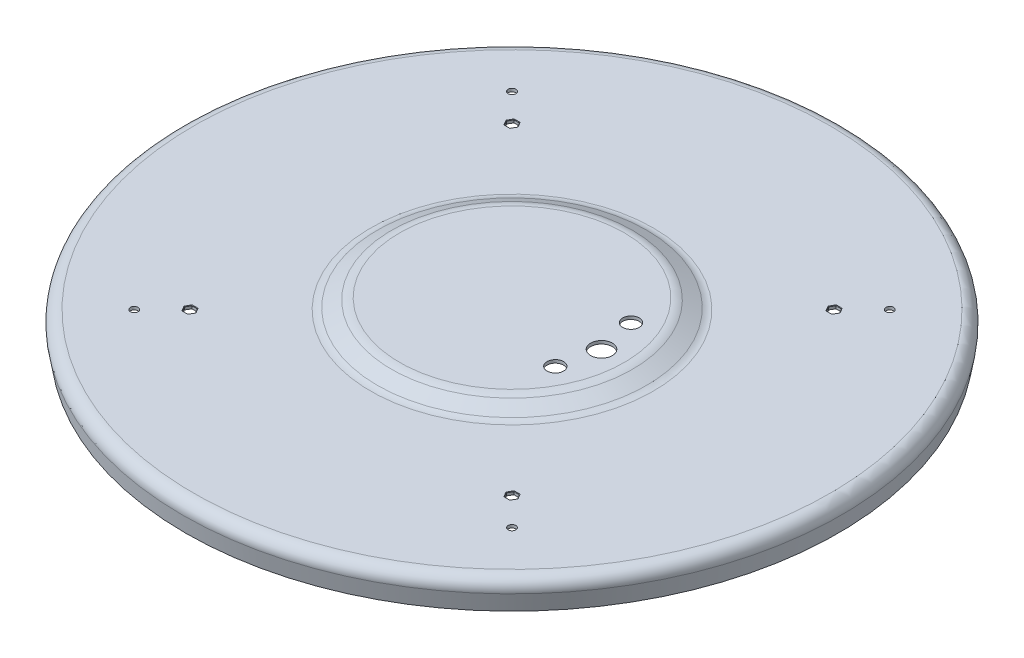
SolidWorks part; units mm, degrees
ref_plane "Plan de face" through (0, 0, 0) normal (0, 0, 1) x (1, 0, 0)
ref_plane "Plan de dessus" through (0, 0, 0) normal (0, 1, 0) x (1, 0, 0)
ref_plane "Plan de droite" through (0, 0, 0) normal (1, 0, 0) x (0, 0, -1)
sketch "Esquisse1" plane through (0, 0, 0) normal (0, 0, 1) x (1, 0, 0)
  line L0 (0, 36.5209) -> (-108.8444, 36.5209)
  line L1 (-115.4199, 35.0029) -> (-129.0754, 28.3426)
  line L2 (-136.9661, 26.5209) -> (-308.321, 26.5209)
  line L3 (-316.2036, 17.1269) -> (-313.2755, 0.5209)
  line L4 (0, 39.5209) -> (-108.8444, 39.5209)
  line L5 (-116.7351, 37.6992) -> (-130.3905, 31.039)
  line L6 (-136.9661, 29.5209) -> (-308.321, 29.5209)
  line L7 (-319.158, 16.6059) -> (-316.2299, 0)
  line L8 (0, -1.5849) -> (0, 41.5149) construction
  line L9 (-313.2755, 0.5209) -> (-316.2299, 0)
  line L10 (0, 39.5209) -> (0, 36.5209)
  arc A0 (-108.8444, 39.5209) -> (-116.7351, 37.6992) centre (-108.8444, 21.5209) ccw
  arc A1 (-136.9661, 29.5209) -> (-130.3905, 31.039) centre (-136.9661, 44.5209) ccw
  arc A4 (-308.321, 29.5209) -> (-319.158, 16.6059) centre (-308.321, 18.5168) ccw
  arc A6 (-108.8444, 36.5209) -> (-115.4199, 35.0029) centre (-108.8444, 21.5209) ccw
  arc A7 (-136.9661, 26.5209) -> (-129.0754, 28.3426) centre (-136.9661, 44.5209) ccw
  arc A8 (-308.321, 26.5209) -> (-316.2036, 17.1269) centre (-308.321, 18.5168) ccw
  point P1 (0, 39.5209)
  point P23 (0, 39.5209)
  dimension "D2" = 18
  dimension "D3" = 15
  dimension "D1" = 108.8444
  dimension "D4" = 308.321
  dimension "D5" = 638.316
  dimension "D6" = 130.3905
  dimension "D7" = 39.5209
  dimension "D8" = 80
  dimension "D9" = 3
  dimension "D10" = 29.5209
  dimension "D14" = 154
revolve "Révolution1" add sketch "Esquisse1" angle 360 about L8
sketch "Esquisse3" plane through (0, 39.5209, 0) normal (0, 1, 0) x (1, 0, 0)
  circle A0 centre (86.74, 0) radius 8.1
  dimension "D1" = 16.2
  dimension "D2" = 86.74
extrude "Extrusion1" cut sketch "Esquisse3" against normal up to next
sketch "Esquisse4" plane through (0, 29.5209, 0) normal (0, 1, 0) x (1, 0, 0)
  line L0 (0, 0) -> (319.3252, 0) construction
  line L1 (0, 0) -> (225.797, 225.797) construction
  line L2 (0, 0) -> (0, 156) construction
  line L3 (153.3731, 151.45) -> (158.6269, 151.45)
  line L4 (158.6269, 151.45) -> (161.2539, 156)
  line L5 (161.2539, 156) -> (158.6269, 160.55)
  line L6 (158.6269, 160.55) -> (153.3731, 160.55)
  line L7 (153.3731, 160.55) -> (150.7461, 156)
  line L8 (150.7461, 156) -> (153.3731, 151.45)
  line L9 (0, 156) -> (156, 156) construction
  circle A0 centre (0, 0) radius 319.3252 construction
  circle A1 centre (182.9992, 182.9992) radius 3.75
  circle A2 centre (156, 156) radius 4.55 construction
  dimension "D2" = 7.5
  dimension "D1" = 45
  dimension "D3" = 258.8
  dimension "D4" = 156
  dimension "D5" = 9.1
extrude "Extrusion2" cut sketch "Esquisse4" against normal up to next
chamfer "Chanfrein1" distance 0.45 angle 45 6 edges at (152.0596, 29.5209, -153.725) (156, 29.5209, -151.45) (159.9404, 29.5209, -153.725) (159.9404, 29.5209, -158.275) (156, 29.5209, -160.55) (152.0596, 29.5209, -158.275)
mirror "Symétrie1" about plane through (0, 0, 0) normal (0, 0, 1) of "Chanfrein1", "Extrusion2"
mirror "Symétrie2" about plane through (0, 0, 0) normal (1, 0, 0) of "Symétrie1", "Extrusion2", "Chanfrein1"
sketch "Esquisse5" plane through (0, 39.5209, 0) normal (0, 1, 0) x (1, 0, 0)
  line L0 (78.6131, 36.6579) -> (0, 0) construction
  line L1 (0, 0) -> (78.6131, -36.6579) construction
  line L2 (0, 0) -> (86.74, 0) construction
  circle A0 centre (0, 0) radius 86.74 construction
  circle A1 centre (78.6131, 36.6579) radius 8
  circle A2 centre (86.74, 0) radius 10.5
  circle A3 centre (78.6131, -36.6579) radius 8
  dimension "D3" = 16
  dimension "D4" = 21
  dimension "D1" = 25
  dimension "D2" = 25
extrude "Extrusion3" cut sketch "Esquisse5" against normal blind 10
